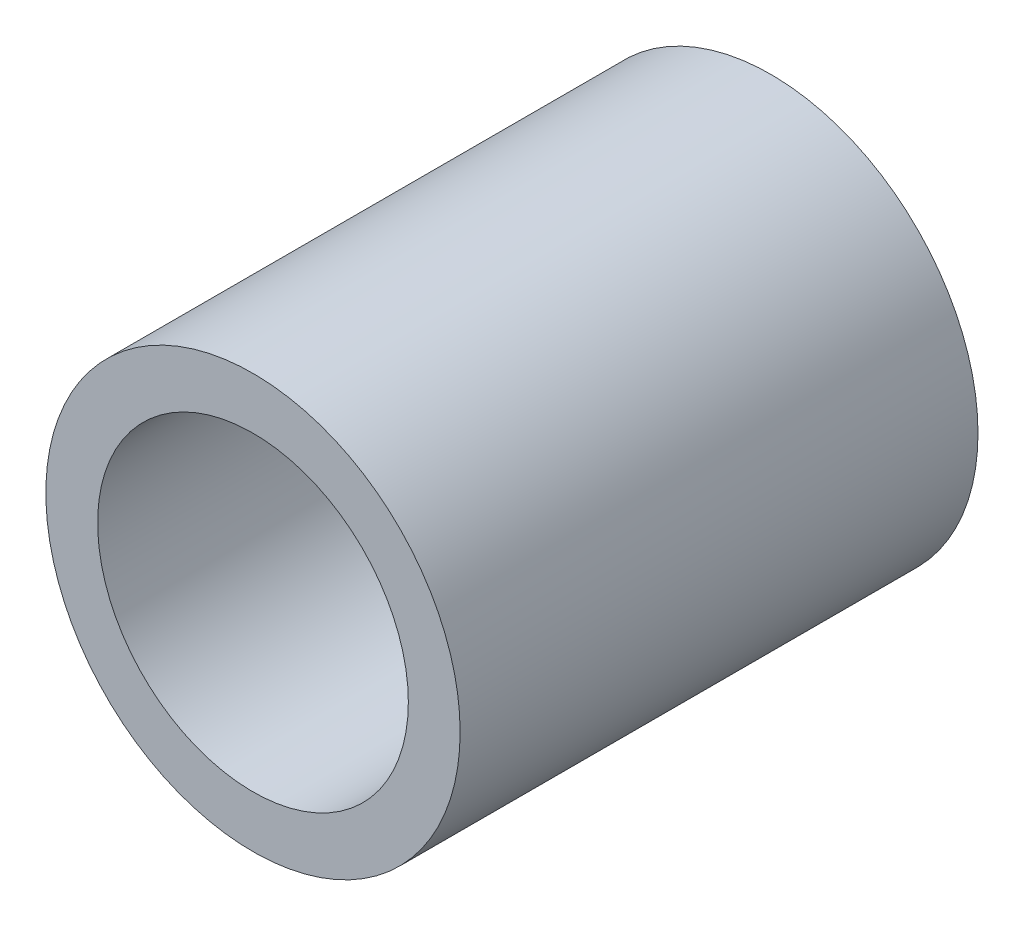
SolidWorks part; units mm, degrees
ref_plane "Plan de face" through (0, 0, 0) normal (0, 0, 1) x (1, 0, 0)
ref_plane "Plan de dessus" through (0, 0, 0) normal (0, 1, 0) x (1, 0, 0)
ref_plane "Plan de droite" through (0, 0, 0) normal (1, 0, 0) x (0, 0, -1)
sketch "Esquisse1" plane through (0, 0, 0) normal (0, 0, 1) x (1, 0, 0)
  circle A0 centre (0, 0) radius 1.5
  circle A1 centre (0, 0) radius 2
  dimension "D1" = 3
  dimension "D2" = 4
extrude "Extrusion1" add sketch "Esquisse1" along normal mid plane 5
